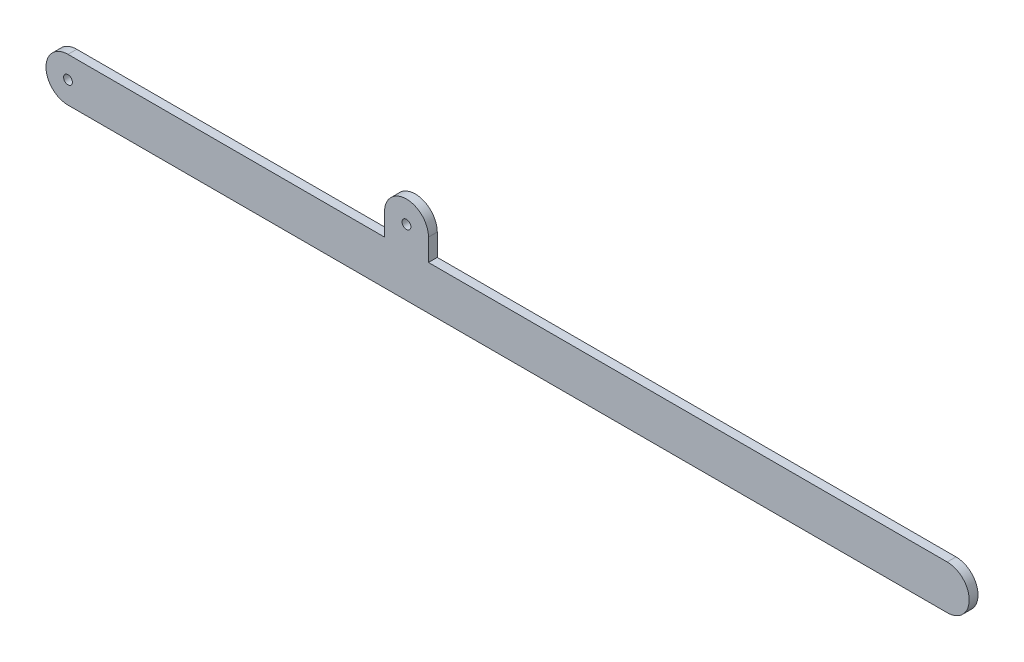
SolidWorks part; units mm, degrees
ref_plane "Plan de face" through (0, 0, 0) normal (0, 0, 1) x (1, 0, 0)
ref_plane "Plan de dessus" through (0, 0, 0) normal (0, 1, 0) x (1, 0, 0)
ref_plane "Plan de droite" through (0, 0, 0) normal (1, 0, 0) x (0, 0, -1)
sketch "Esquisse1" plane through (0, 0, 0) normal (0, 0, 1) x (1, 0, 0)
  line L0 (0, 0) -> (1000, 0) construction
  line L1 (0, 25) -> (1000, 25)
  line L2 (0, -25) -> (1000, -25)
  line L3 (385, 0) -> (385, 50) construction
  line L4 (360, 0) -> (360, 50)
  line L5 (410, 0) -> (410, 50)
  arc A0 (0, 25) -> (0, -25) centre (0, 0) ccw
  arc A1 (1000, -25) -> (1000, 25) centre (1000, 0) ccw
  arc A2 (360, 0) -> (410, 0) centre (385, 0) ccw
  arc A3 (410, 50) -> (360, 50) centre (385, 50) ccw
  point P3 (500, 0)
  point P10 (385, 25)
  dimension "D1" = 50
  dimension "D2" = 1000
  dimension "D3" = 50
  dimension "D4" = 385
  dimension "D5" = 50
extrude "Boss.-Extru.1" add sketch "Esquisse1" along normal blind 10 contours A2 L4 L1 A0 L2 | L4 A2 L5 L1 | L5 A3 L4 L1 | A2 L2 A1 L1 L5
sketch "Esquisse2" plane through (0, 0, 10) normal (0, 0, 1) x (1, 0, 0)
  circle A0 centre (0, 0) radius 5
  circle A1 centre (385, 50) radius 5
  dimension "D1" = 10
  dimension "D2" = 10
extrude "Enlèv. mat.-Extru.1" cut sketch "Esquisse2" against normal through all
